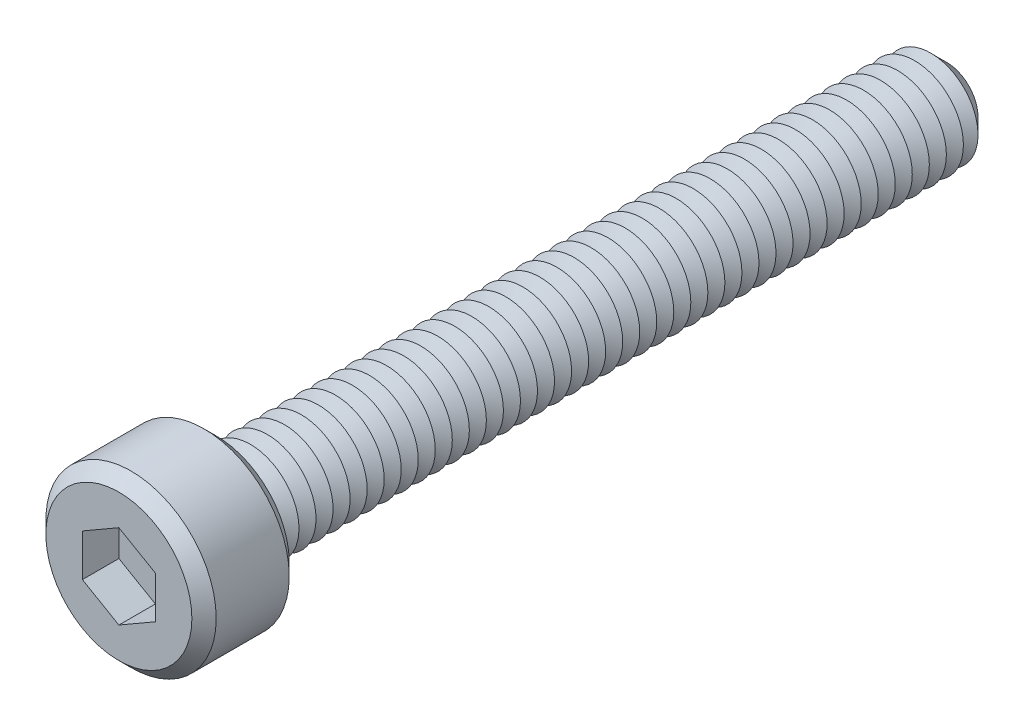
SolidWorks part; units mm, degrees
ref_plane "Front Plane" through (0, 0, 0) normal (0, 0, 1) x (1, 0, 0)
ref_plane "Top Plane" through (0, 0, 0) normal (0, 1, 0) x (1, 0, 0)
ref_plane "Right Plane" through (0, 0, 0) normal (1, 0, 0) x (0, 0, -1)
sketch "Sketch1" plane through (0, 0, 0) normal (0, 0, 1) x (1, 0, 0)
  circle A0 centre (0, 0) radius 3.5
  dimension "D1" = 7
extrude "Boss-Extrude1" add sketch "Sketch1" along normal blind 4
sketch "Sketch2" plane through (0, 0, 0) normal (0, 0, -1) x (-1, 0, 0)
  circle A0 centre (0, 0) radius 2
  dimension "D1" = 4
extrude "Boss-Extrude2" add sketch "Sketch2" along normal blind 30
chamfer "Chamfer1" distance 0.7 angle 45 1 edges at (-2, 0, -30)
sketch "Sketch3" plane through (0, 0, 0) normal (1, 0, 0) x (0, 0, -1)
  line L0 (-2.5121, 0) -> (4.5776, 0) construction
sketch "Sketch4" plane through (0, 0, 0) normal (1, 0, 0) x (0, 0, -1)
  line L0 (0, 2) -> (0.35, 1.3938)
  line L1 (0.35, 1.3938) -> (0.7, 2)
  line L2 (29.3, 2) -> (0, 2) construction
  line L3 (0.7, 2) -> (0, 2)
  dimension "D1" = 0.7
revolve "Cut-Revolve1" cut sketch "Sketch4" angle 360 about L0
pattern_linear "LPattern1" count 42 spacing 0.7 along (0, 0, -1) of "Cut-Revolve1"
sketch "Sketch5" plane through (0, 0, 4) normal (0, 0, 1) x (1, 0, 0)
  line L1 (0, 1.7321) -> (-1.5, 0.866)
  line L2 (-1.5, 0.866) -> (-1.5, -0.866)
  line L3 (-1.5, -0.866) -> (0, -1.7321)
  line L4 (0, -1.7321) -> (1.5, -0.866)
  line L5 (1.5, -0.866) -> (1.5, 0.866)
  line L6 (1.5, 0.866) -> (0, 1.7321)
  circle A0 centre (0, 0) radius 1.5 construction
  dimension "D1" = 3
extrude "Cut-Extrude1" cut sketch "Sketch5" against normal blind 1.5
sketch "Sketch6" plane through (0, 0, 2.5) normal (0, 0, 1) x (1, 0, 0)
  circle A0 centre (0, 0) radius 0.5
  dimension "D1" = 1
extrude "Cut-Extrude2" cut sketch "Sketch6" against normal up to surface (32.5 mm away)
chamfer "Chamfer2" distance 0.5 angle 45 2 edges at (3.5, 0, 0) (3.5, 0, 4)
